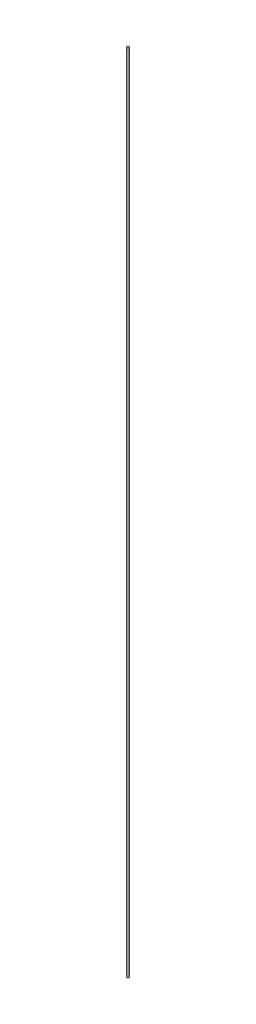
SolidWorks part; units mm, degrees
ref_plane "Plan de face" through (0, 0, 0) normal (0, 0, 1) x (1, 0, 0)
ref_plane "Plan de dessus" through (0, 0, 0) normal (0, 1, 0) x (1, 0, 0)
ref_plane "Plan de droite" through (0, 0, 0) normal (1, 0, 0) x (0, 0, -1)
sketch "Esquisse1" plane through (0, 0, 0) normal (0, 1, 0) x (1, 0, 0)
  circle A0 centre (0, 0) radius 1.5
  dimension "D1" = 3
extrude "Extrusion1" add sketch "Esquisse1" along normal blind 1071
